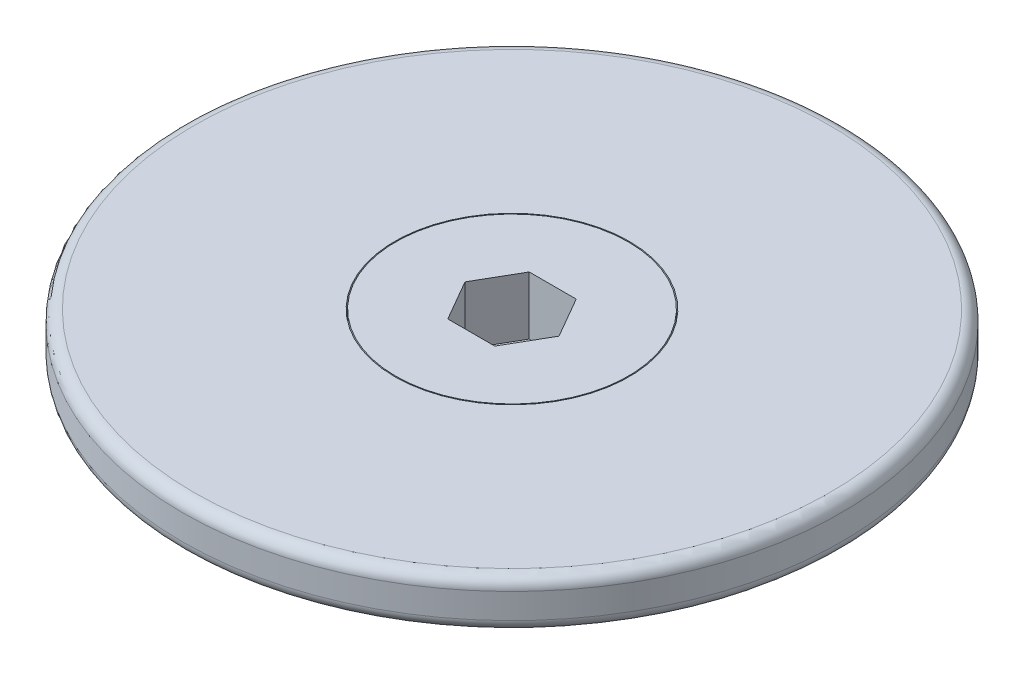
SolidWorks part; units mm, degrees
ref_plane "Front Plane" through (0, 0, 0) normal (0, 0, 1) x (1, 0, 0)
ref_plane "Top Plane" through (0, 0, 0) normal (0, 1, 0) x (1, 0, 0)
ref_plane "Right Plane" through (0, 0, 0) normal (1, 0, 0) x (0, 0, -1)
sketch "Sketch1" plane through (0, 0, 0) normal (0, 1, 0) x (1, 0, 0)
  circle A0 centre (0, 0) radius 17
  circle A1 centre (0, 0) radius 6.05
  dimension "D1" = 34
  dimension "D2" = 12.1
extrude "Boss-Extrude1" add sketch "Sketch1" along normal blind 2.5
sketch "Sketch2" plane through (0, 2.5, 0) normal (0, 1, 0) x (1, 0, 0)
  circle A0 centre (0, 0) radius 6
  dimension "D1" = 12
extrude "Boss-Extrude2" add sketch "Sketch2" against normal blind 4 separate body
sketch "Sketch3" plane through (0, 2.5, 0) normal (0, 1, 0) x (1, 0, 0)
  line L1 (1.2124, -2.1) -> (2.4249, 0)
  line L2 (2.4249, 0) -> (1.2124, 2.1)
  line L3 (1.2124, 2.1) -> (-1.2124, 2.1)
  line L4 (-1.2124, 2.1) -> (-2.4249, 0)
  line L5 (-2.4249, 0) -> (-1.2124, -2.1)
  line L6 (-1.2124, -2.1) -> (1.2124, -2.1)
  circle A0 centre (0, 0) radius 2.1 construction
  dimension "D1" = 4.2
extrude "Cut-Extrude1" cut sketch "Sketch3" against normal blind 3
fillet "Fillet1" radius 0.6 2 edges at (0, 0, 17) (0, 2.5, 17)
